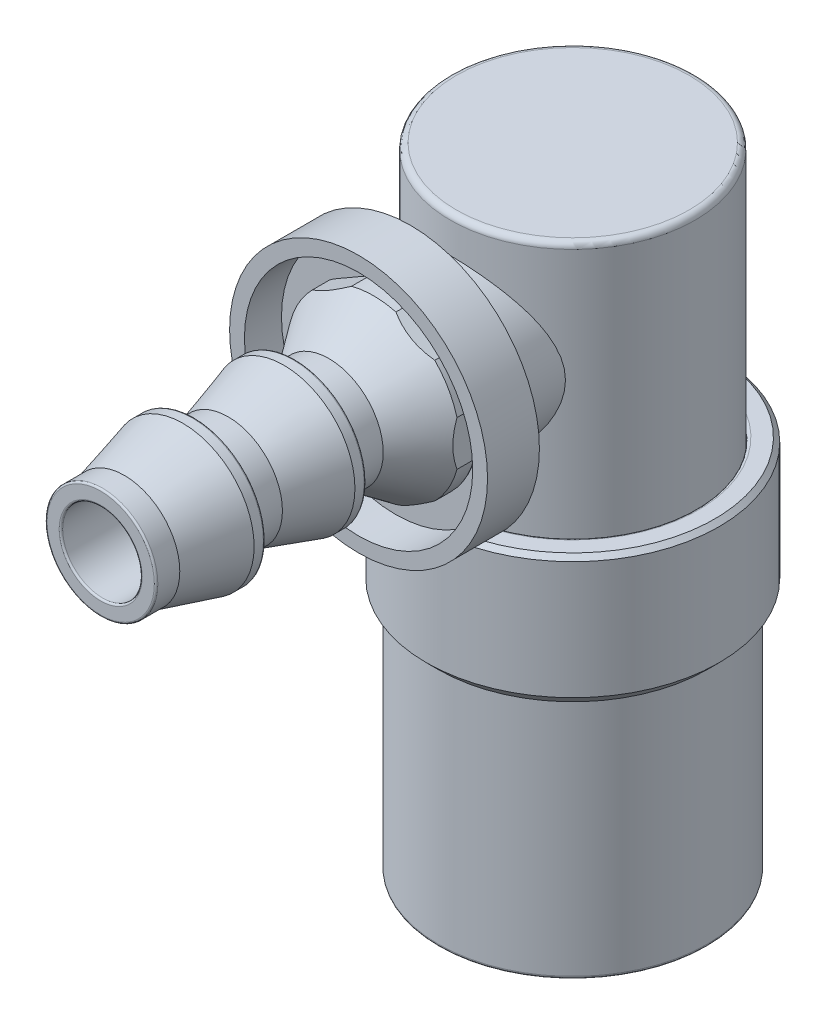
SolidWorks part; units mm, degrees
other "BODY_"
ref_plane "Front Plane" through (0, 0, 0) normal (0, 0, 1) x (1, 0, 0)
ref_plane "Top Plane" through (0, 0, 0) normal (0, 1, 0) x (1, 0, 0)
ref_plane "Right Plane" through (0, 0, 0) normal (1, 0, 0) x (0, 0, -1)
imported_body "PL-BARB"
imported_body "BARB"
imported_body "SC200S"
imported_body "BODY"
imported_body "SLEEVE"
sketch "Sketch2" plane through (0, 0, 0) normal (1, 0, 0) x (0, 0, -1)
  line L0 (-6.7437, 1.016) -> (-4.7625, 2.9972)
  line L1 (-4.7625, 2.9972) -> (-4.7625, 11.1863)
  line L2 (-4.7625, 11.1863) -> (-6.7437, 13.0794)
  line L3 (-6.7437, 13.0794) -> (-6.7437, 1.016)
  line L4 (0, 8.7926) -> (0, -2.6506) construction
  dimension "D1" = 9.525
revolve "Revolve1" add sketch "Sketch2" angle 360 about L4
sketch "Sketch3" plane through (0, 0, 0) normal (0, -1, 0) x (1, 0, 0)
  line L1 (6.477, 3.7395) -> (0, 7.479)
  line L2 (0, 7.479) -> (-6.477, 3.7395)
  line L3 (-6.477, 3.7395) -> (-6.477, -3.7395)
  line L4 (-6.477, -3.7395) -> (0, -7.479)
  line L5 (0, -7.479) -> (6.477, -3.7395)
  line L6 (6.477, -3.7395) -> (6.477, 3.7395)
  circle A0 centre (0, 0) radius 6.477 construction
  dimension "D1" = 12.954
extrude "Cut-Extrude1" cut sketch "Sketch3" against normal up to surface (15.5119 mm away)
